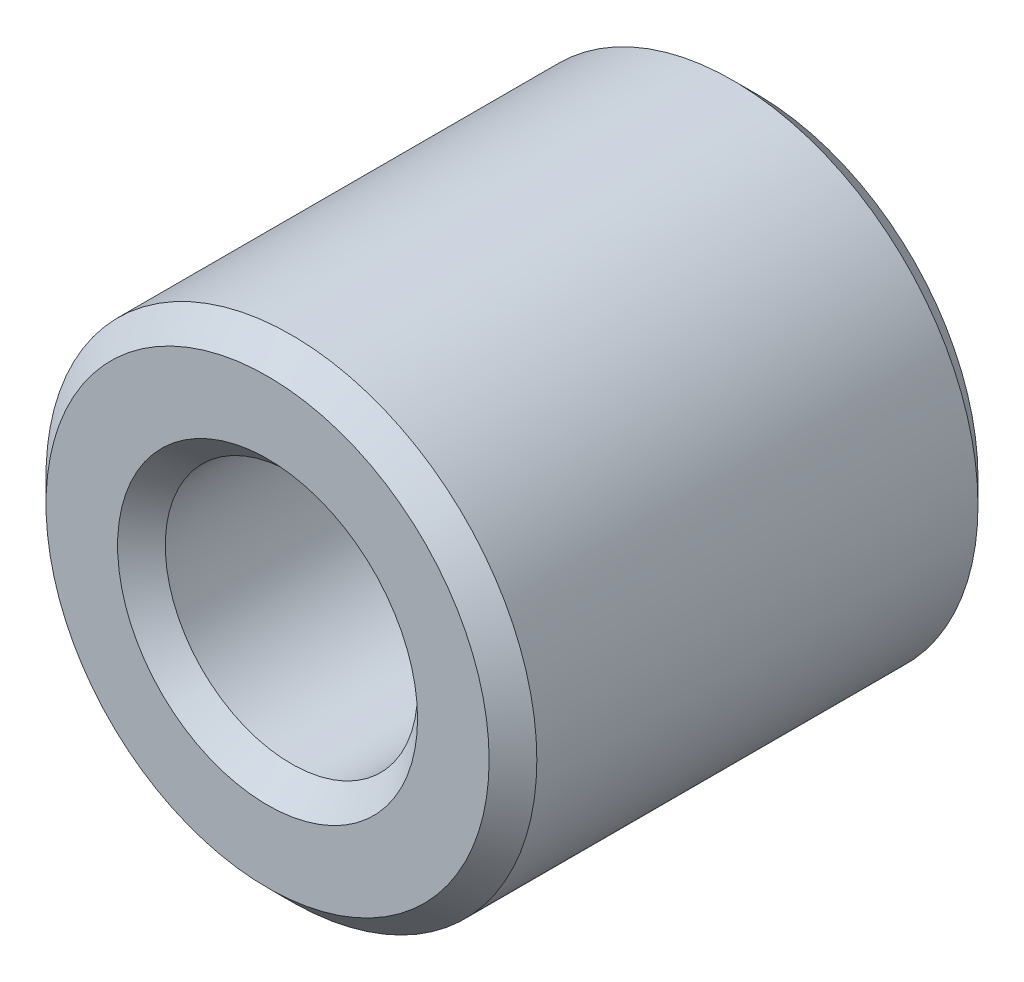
SolidWorks part; units mm, degrees
ref_plane "Front Plane" through (0, 0, 0) normal (0, 0, 1) x (1, 0, 0)
ref_plane "Top Plane" through (0, 0, 0) normal (0, 1, 0) x (1, 0, 0)
ref_plane "Right Plane" through (0, 0, 0) normal (1, 0, 0) x (0, 0, -1)
sketch "Sketch1" plane through (0, 0, 0) normal (0, 0, 1) x (1, 0, 0)
  line L0 (-1.6383, 0) -> (1.6383, 0) construction
  line L1 (-3.1877, 0) -> (3.1877, 0) construction
  point P4 (0, 0)
  point P8 (0, 0)
sketch "Sketch2" plane through (0, 0, 0) normal (1, 0, 0) x (0, 0, -1)
  line L0 (0, 3.1877) -> (0, -3.1877) construction
  line L1 (-3.175, 3.1877) -> (3.175, 3.1877) construction
  point P4 (0, 0)
  point P7 (0, 3.1877)
sketch "Sketch3" plane through (0, 0, 0) normal (0, 0, 1) x (1, 0, 0)
  line L0 (0, 3.1877) -> (0, -3.1877) construction
  circle A0 centre (0, 0) radius 1.6383
  circle A1 centre (0, 0) radius 3.1877
extrude "Boss-Extrude1" add sketch "Sketch3" along normal mid plane 6.35
chamfer "Chamfer1" distance 0.3099 angle 45 4 edges at (1.6383, 0, -3.175) (3.1877, 0, -3.175) (1.6383, 0, 3.175) (3.1877, 0, 3.175)
equation "\"D1@Sketch2\"=\"OD@sketch1\""
equation "\"D1@Boss-Extrude1\"=\"Length@sketch2\""
equation "\"D1@Chamfer1\"=(  ( \"OD@Sketch1\" - \"ID@Sketch1\" )  / 2 )  * .2"
